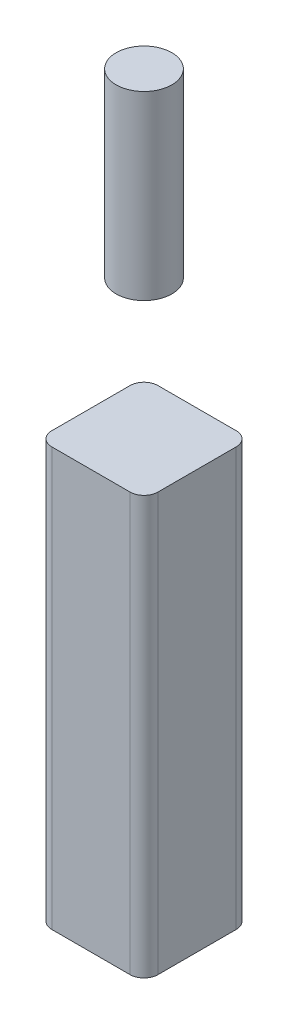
SolidWorks part; units mm, degrees
ref_plane "Front Plane" through (0, 0, 0) normal (0, 0, 1) x (1, 0, 0)
ref_plane "Top Plane" through (0, 0, 0) normal (0, 1, 0) x (1, 0, 0)
ref_plane "Right Plane" through (0, 0, 0) normal (1, 0, 0) x (0, 0, -1)
sketch "Sketch1" plane through (0, 0, 0) normal (0, 1, 0) x (1, 0, 0)
  line L1 (-19.05, -19.05) -> (19.05, -19.05)
  line L2 (-19.05, -19.05) -> (-19.05, 19.05)
  line L3 (-19.05, 19.05) -> (19.05, 19.05)
  line L4 (19.05, -19.05) -> (19.05, 19.05)
  line L5 (0, 19.05) -> (0, -19.05) construction
  line L6 (-19.05, 0) -> (19.05, 0) construction
  point P0 (0, 0)
  dimension "D1" = 38.1
extrude "Boss-Extrude1" add sketch "Sketch1" along normal blind 150
fillet "Fillet1" radius 5 4 edges at (19.05, 75, 19.05) (-19.05, 75, -19.05) (19.05, 75, -19.05) (-19.05, 75, 19.05)
ref_plane "Plane1" through (0, 265, 0) normal (0, 1, 0) x (1, 0, 0)
sketch "Sketch2" plane through (0, 265, 0) normal (0, 1, 0) x (1, 0, 0)
  circle A0 centre (0, 0) radius 10
  dimension "D1" = 20
extrude "Boss-Extrude2" add sketch "Sketch2" against normal blind 65 separate body
